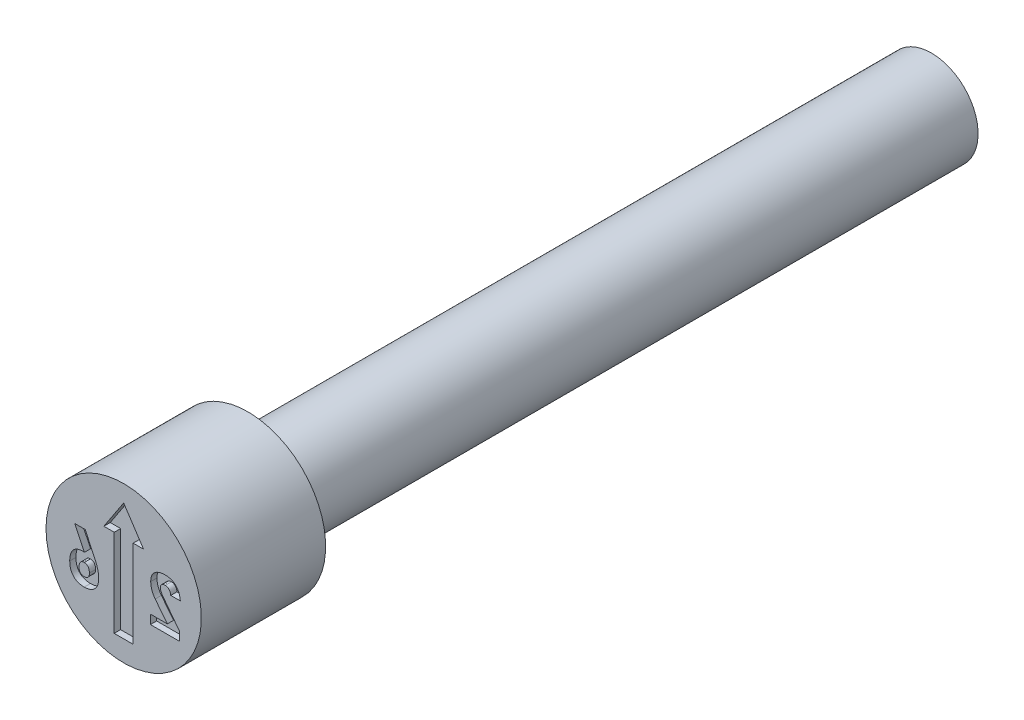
SolidWorks part; units mm, degrees
ref_plane "Front Plane" through (0, 0, 0) normal (0, 0, 1) x (1, 0, 0)
ref_plane "Top Plane" through (0, 0, 0) normal (0, 1, 0) x (1, 0, 0)
ref_plane "Right Plane" through (0, 0, 0) normal (1, 0, 0) x (0, 0, -1)
imported_body "Imported1"
sketch "Sketch1" plane through (0, 0, -0.2134) normal (0, 0, 1) x (1, 0, 0)
  line L7 (0.3192, 0.4953) -> (0, 0.9799)
  line L8 (0, 0.9799) -> (-0.3192, 0.4953)
  line L9 (-0.3192, 0.4953) -> (-0.1524, 0.4953)
  line L10 (-0.1524, 0.4953) -> (-0.1524, -0.9144)
  line L11 (-0.1524, -0.9144) -> (0.1524, -0.9144)
  line L12 (0.1524, -0.9144) -> (0.1524, 0.4953)
  line L13 (0.1524, 0.4953) -> (0.3192, 0.4953)
  line L14 (0.3192, 0.4953) -> (0, 0.9799)
  line L15 (0, 0.9799) -> (-0.3192, 0.4953)
  line L16 (-0.3192, 0.4953) -> (-0.1524, 0.4953)
  line L17 (-0.1524, 0.4953) -> (-0.1524, -0.9144)
  line L18 (-0.1524, -0.9144) -> (0.1524, -0.9144)
  line L19 (0.1524, -0.9144) -> (0.1524, 0.4953)
  line L20 (0.1524, 0.4953) -> (0.3192, 0.4953)
  dimension "D1" = 0
extrude "Boss-Extrude1" add sketch "Sketch1" along normal blind 0.11
sketch "Sketch2" plane through (0, 0, 0) normal (0, 0, 1) x (1, 0, 0)
  text T0 "2   6" font "Bahnschrift" height 0.8
  dimension "D2" = 0.5
extrude "Cut-Extrude1" cut sketch "Sketch2" against normal blind 0.1
